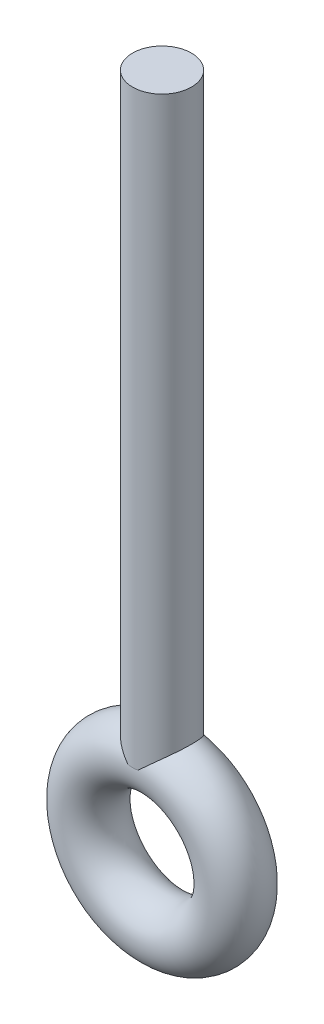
SolidWorks part; units mm, degrees
ref_plane "Front Plane" through (0, 0, 0) normal (0, 0, 1) x (1, 0, 0)
ref_plane "Top Plane" through (0, 0, 0) normal (0, 1, 0) x (1, 0, 0)
ref_plane "Right Plane" through (0, 0, 0) normal (1, 0, 0) x (0, 0, -1)
sketch "Sketch1" plane through (0, 0, 0) normal (0, 1, 0) x (1, 0, 0)
  line L0 (-55, 0) -> (55, 0) construction
  line L1 (0, 26.0951) -> (0, -29.4115) construction
  line L2 (0, -55) -> (0, 55) construction
  circle A0 centre (-7.5, 0) radius 3
revolve "Revolve1" add sketch "Sketch1" angle 360 about L1
ref_plane "Plane1" through (0, 8, 0) normal (0, 1, 0) x (1, 0, 0)
sketch "Sketch2" plane through (0, 8, 0) normal (0, 1, 0) x (1, 0, 0)
  circle A0 centre (0, 0) radius 3
extrude "Boss-Extrude1" add sketch "Sketch2" along normal blind 60
